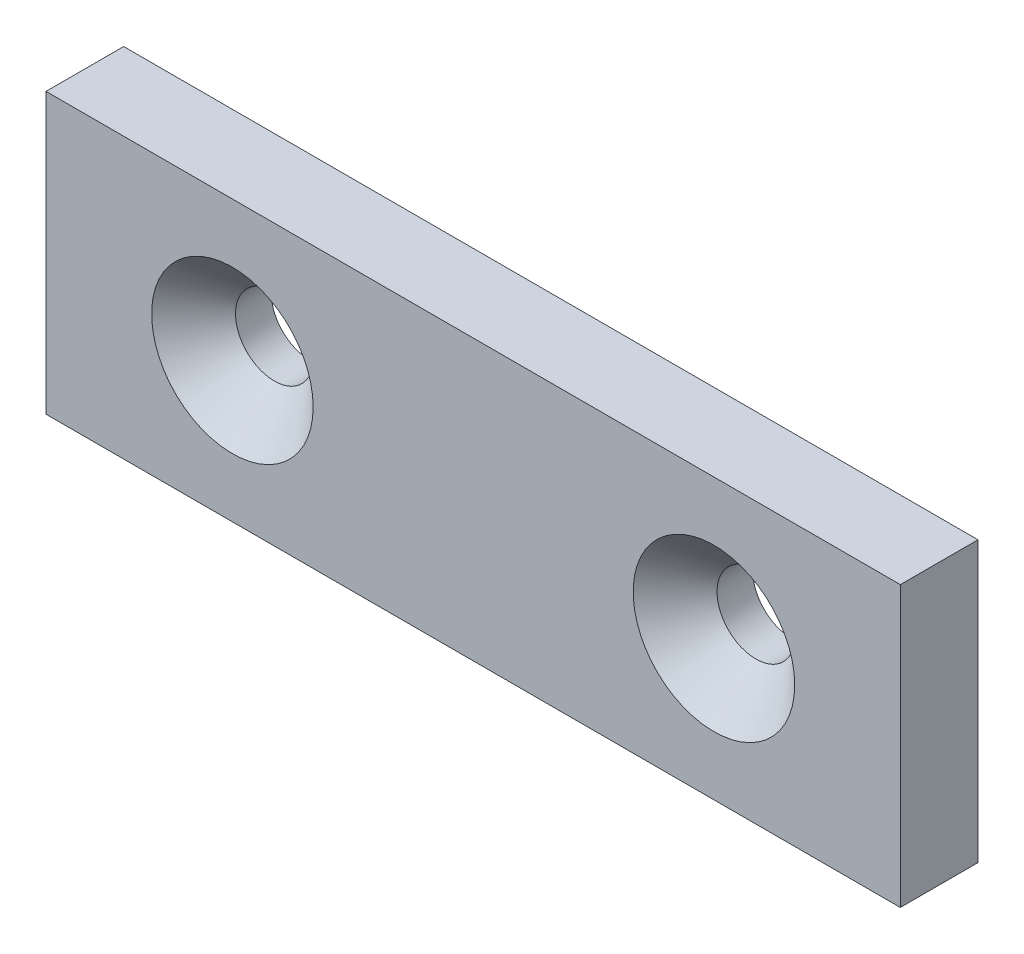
SolidWorks part; units mm, degrees
ref_plane "Front Plane" through (0, 0, 0) normal (0, 0, 1) x (1, 0, 0)
ref_plane "Top Plane" through (0, 0, 0) normal (0, 1, 0) x (1, 0, 0)
ref_plane "Right Plane" through (0, 0, 0) normal (1, 0, 0) x (0, 0, -1)
sketch "Sketch2" plane through (0, 0, 0) normal (0, 0, 1) x (1, 0, 0)
  line L1 (0, 0) -> (55, 0)
  line L2 (0, 0) -> (0, 18)
  line L3 (0, 18) -> (55, 18)
  line L4 (55, 0) -> (55, 18)
  dimension "D1" = 55
  dimension "D2" = 18
extrude "Boss-Extrude1" add sketch "Sketch2" along normal blind 5
sketch "Sketch3" plane through (0, 0, 5) normal (0, 0, 1) x (1, 0, 0)
  line L0 (0, 18) -> (0, 0) construction
  line L1 (0, 0) -> (55, 0) construction
  line L2 (55, 0) -> (55, 18) construction
  point P0 (12, 9)
  point P1 (43, 9)
  dimension "D1" = 12
  dimension "D2" = 9
  dimension "D3" = 12
  dimension "D4" = 9
hole_wizard "CSK for M5 Flat Head Machine Screw1" positions "3DSketch1" profile "Sketch4" countersink size "M5" standard "ANSI Metric"
sketch3d "3DSketch1"
  point P0 (12, 9, 5)
  point P3 (43, 9, 5)
sketch "Sketch4" plane through (12, 9, 5) normal (1, 0, 0) x (0, -1, 0)
  line L0 (0, 0) -> (0, 5)
  line L1 (0, 5) -> (2.5, 5)
  line L2 (2.5, 5) -> (2.5, 2.7)
  line L3 (2.5, 2.7) -> (5.2, 0)
  line L5 (5.2, 0) -> (0, 0)
  line L6 (-2.5, 2.7) -> (-5.2, 0) construction
  line L11 (0, -6.35) -> (0, 107.95) construction
  dimension "Thru Hole Dia." = 5
  dimension "Thru Hole Depth" = 5
  dimension "Near C'Sink Dia." = 10.4
  dimension "Near C'Sink Angle" = 90
